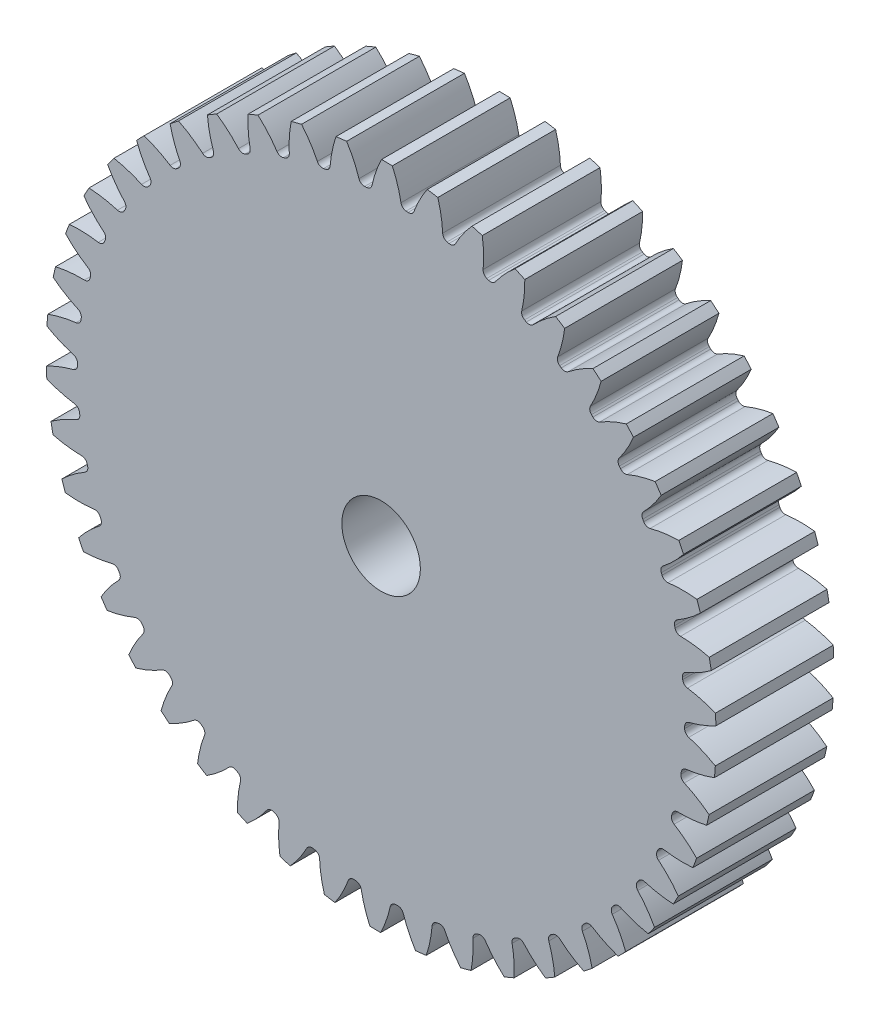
SolidWorks part; units mm, degrees
ref_plane "Front" through (0, 0, 0) normal (0, 0, 1) x (1, 0, 0)
ref_plane "Top" through (0, 0, 0) normal (0, 1, 0) x (1, 0, 0)
ref_plane "Right" through (0, 0, 0) normal (1, 0, 0) x (0, 0, -1)
sketch "Sketch3" plane through (0, 0, 0) normal (0, 0, 1) x (1, 0, 0)
  circle A0 centre (0, 0) radius 270.9333
  dimension "od" = 541.8667
extrude "gearBody" add sketch "Sketch3" along normal blind 95.25
sketch "Sketch2" plane through (0, 0, 0) normal (0, 0, 1) x (1, 0, 0)
  line L0 (0, 0) -> (225.4136, 93.3694) construction
  line L1 (270.4357, -18.9736) -> (0, 0) construction
  line L2 (0, 0) -> (36.3143, 0) construction
  line L3 (259.6089, 4.2988) -> (259.3005, -13.3609) construction
  line L5 (259.4547, -4.531) -> (0, 0) construction
  line L7 (0, 0) -> (243.986, 0) construction
  arc A0 (243.9859, -0.2145) -> (243.8446, -8.3048) centre (0, 0) ccw construction
  arc A1 (270.7692, 9.4304) -> (270.2748, -18.879) centre (0, 0) ccw construction
  arc A2 (259.6089, 4.2988) -> (259.3005, -13.3609) centre (0, 0) ccw construction
  arc A3 (245.4803, -5.1009) -> (245.5088, -3.4736) centre (0, 0) ccw
  arc A4 (270.4357, -18.9736) -> (248.7848, -9.6063) centre (222.0161, -101.1831) ccw
  arc A5 (270.4357, -18.9736) -> (270.9333, 9.5193) centre (0, 0) ccw
  arc A6 (270.9333, 9.5193) -> (248.9686, 0.9138) centre (225.4136, 93.3694) cw
  arc A7 (245.5088, -3.4736) -> (248.9686, 0.9138) centre (250.1029, -3.5386) cw
  arc A8 (248.7848, -9.6063) -> (245.4803, -5.1009) centre (250.0739, -5.1963) cw
  point P6 (270.9333, 9.5193)
  point P22 (270.4357, -18.9736)
  dimension "baseDia" = 487.9719
  dimension "od" = 541.8667
  dimension "pd" = 519.2889
  dimension "rd" = 491.0667
  dimension "rFillet" = 4.5946
  dimension "pointX" = 270.9333
  dimension "pointY" = 9.5193
  dimension "CTT" = 17.6597
  dimension "flankCenterAngle" = 22.5
extrude "toothCut" cut sketch "Sketch2" along normal through all
pattern_circular "CirPattern1" count 46 over 360 about axis through (0, 0, 0) along (0, 0, 1) of "toothCut"
sketch "hub1Dia" plane through (0, 0, 0) normal (0, 0, -1) x (-1, 0, 0)
  circle A0 centre (0, 0) radius 12.7
  dimension "hub1Dia" = 25.4
sketch "hub2Dia" plane through (0, 0, 95.25) normal (0, 0, 1) x (1, 0, 0)
  circle A0 centre (0, 0) radius 12.7
  dimension "hub2dia" = 25.4
sketch "boreDia" plane through (0, 0, 0) normal (0, 0, 1) x (1, 0, 0)
  circle A0 centre (0, 0) radius 31.75
  dimension "boreDia" = 63.5
extrude "bore" cut sketch "boreDia" against normal mid plane 25400
